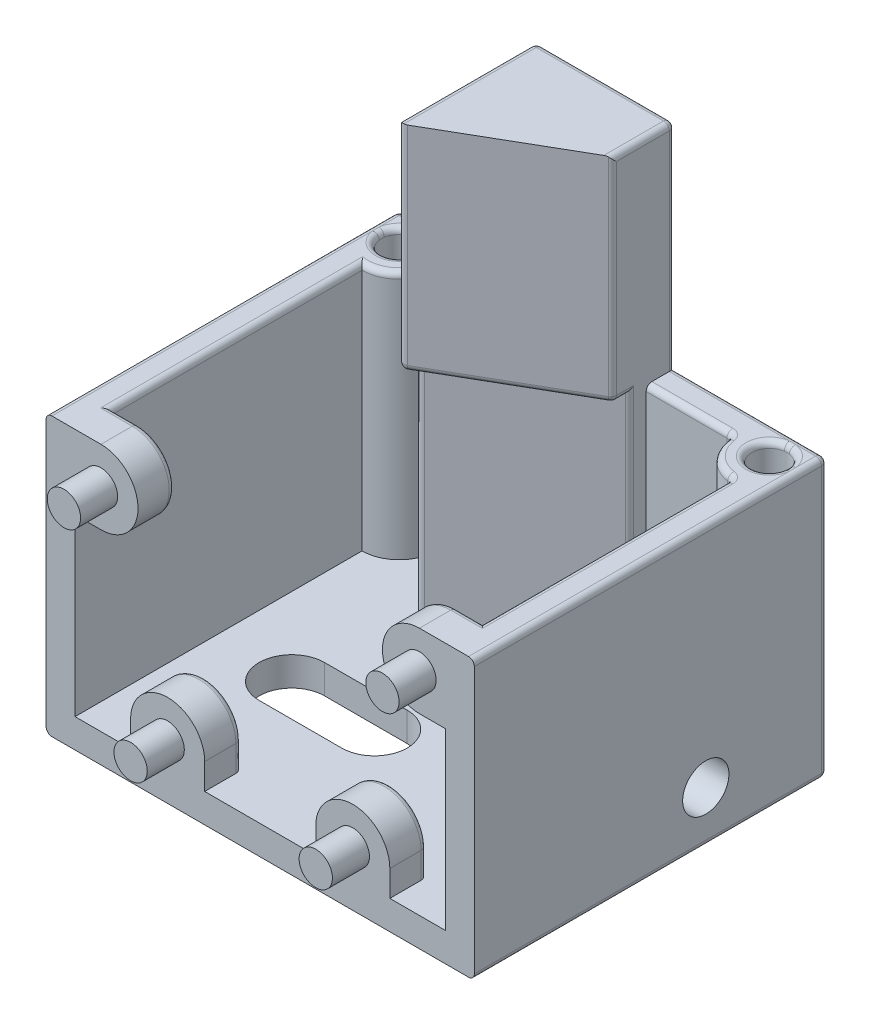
SolidWorks part; units mm, degrees
ref_plane "Front Plane" through (0, 0, 0) normal (0, 0, 1) x (1, 0, 0)
ref_plane "Top Plane" through (0, 0, 0) normal (0, 1, 0) x (1, 0, 0)
ref_plane "Right Plane" through (0, 0, 0) normal (1, 0, 0) x (0, 0, -1)
body saved out of another part "Stock-AirJetCasing-1"
sketch "Sketch1" plane through (0, 0, 0.635) normal (0, 0, -1) x (-1, 0, 0)
  circle A0 centre (10.922, 16.51) radius 1.27
  circle A1 centre (10.922, 16.51) radius 1.27 construction
  circle A2 centre (6.35, 3.7624) radius 1.27
  circle A3 centre (-6.35, 3.7624) radius 1.27
  circle A4 centre (-10.922, 16.51) radius 1.27
  circle A5 centre (6.35, 3.7624) radius 1.27 construction
  circle A6 centre (-6.35, 3.7624) radius 1.27 construction
  circle A7 centre (-10.922, 16.51) radius 1.27 construction
extrude "Boss-Extrude1" add sketch "Sketch1" against normal blind 5.08
sketch "Sketch2" plane through (0, 0, 5.715) normal (0, 0, 1) x (1, 0, 0)
  circle A0 centre (-10.922, 16.51) radius 1.143
  circle A1 centre (-10.922, 16.51) radius 1.27 construction
  circle A2 centre (-10.922, 16.51) radius 1.27
  circle A3 centre (-6.35, 3.7624) radius 1.143
  circle A4 centre (-6.35, 3.7624) radius 1.27
  circle A5 centre (-6.35, 3.7624) radius 1.27 construction
  circle A6 centre (6.35, 3.7624) radius 1.143
  circle A7 centre (6.35, 3.7624) radius 1.27
  circle A8 centre (10.922, 16.51) radius 1.27
  circle A9 centre (10.922, 16.51) radius 1.143
  circle A10 centre (10.922, 16.51) radius 1.27 construction
  circle A11 centre (6.35, 3.7624) radius 1.27 construction
  dimension "D1" = 0.127
  dimension "D2" = 0.127
  dimension "D3" = 0.127
  dimension "D4" = 0.127
extrude "Cut-Extrude1" cut sketch "Sketch2" against normal blind 2.54
sketch "Sketch5" plane through (0, 7.0644, 0) normal (0, 1, 0) x (1, 0, 0)
  line L0 (1.3494, 12.7) -> (12.7, 12.7) construction
  line L1 (12.7, 16.1401) -> (12.7, 7.62) construction
  arc A0 (6.4294, 17.78) -> (6.4294, 7.62) centre (6.4294, 12.7) ccw construction
sketch "Sketch4" plane through (14.6844, 0, 0) normal (1, 0, 0) x (0, 0, -1)
  line L0 (-3.175, 3.5322) -> (20.6375, 3.5322) construction
  line L1 (-3.175, 18.6531) -> (-3.175, 0.3969) construction
  line L2 (20.6375, 0.3969) -> (20.6375, 18.6531) construction
  line L3 (-3.175, 0) -> (20.6375, 0) construction
  line L4 (20.6375, 0) -> (-3.175, 0) construction
  line L5 (-3.175, 7.0644) -> (20.6375, 7.0644) construction
  line L6 (16.1401, 7.0644) -> (7.62, 7.0644) construction
  line L7 (8.7312, 7.0644) -> (8.7312, 0) construction
  line L8 (12.7, 7.0644) -> (12.7, 0) construction
  point P16 (8.7312, 3.5322)
  point P19 (12.7, 3.5322)
hole_wizard "1/8 (0.125) Diameter Hole1" positions "3DSketch1" profile "Sketch6" hole size "1/8" standard "ANSI Inch"
sketch3d "3DSketch1"
  point P0 (14.6844, 3.5322, -12.7)
sketch "Sketch6" plane through (14.6844, 3.5322, -12.7) normal (0, 1, 0) x (0, 0, -1)
  line L0 (0, 0) -> (0, 5.0165)
  line L1 (0, 5.0165) -> (1.5875, 5.0165)
  line L2 (1.5875, 5.0165) -> (1.5875, 0)
  line L5 (1.5875, 0) -> (0, 0)
  line L11 (0, -6.35) -> (0, 107.95) construction
  dimension "Thru Hole Dia." = 3.175
  dimension "Thru Hole Depth" = 5.0165
sketch "Sketch7" plane through (0, 1.9844, 0) normal (0, 1, 0) x (1, 0, 0)
  line L0 (3.81, -3.175) -> (-3.81, -3.175) construction
  line L4 (-4.5244, 19.05) -> (-4.5244, -3.175) construction
  line L6 (-8.89, -3.175) -> (-12.7, -3.175) construction
  line L7 (-14.6844, 20.6375) -> (-14.6844, -3.175) construction
  point P0 (-4.5244, 6.35)
  dimension "D1" = 9.525
  dimension "D2" = 10.16
hole_wizard "#8 Clearance Slot1" positions "Sketch10" profile "Sketch8" size "#8" standard "ANSI Inch"
sketch "Sketch10" plane through (0, 1.9844, 0) normal (0, 1, 0) x (1, 0, 0)
  line L0 (0.5556, 6.35) -> (-9.6044, 6.35) construction
  line L2 (3.81, -3.175) -> (-3.81, -3.175) construction
  point P0 (-4.5244, 6.35)
  dimension "D1" = 10.16
sketch "Sketch8" plane through (-4.5244, 1.9844, -6.35) normal (1, 0, 0) x (0, 0, 1)
  line L0 (0, 0) -> (0, 1.9844)
  line L1 (0, 1.9844) -> (2.2479, 1.9844)
  line L2 (2.2479, 1.9844) -> (2.2479, 0)
  line L5 (2.2479, 0) -> (0, 0)
  line L11 (0, -6.35) -> (0, 107.95) construction
  dimension "Thru Hole Dia." = 4.4958
  dimension "Thru Hole Depth" = 1.9844
